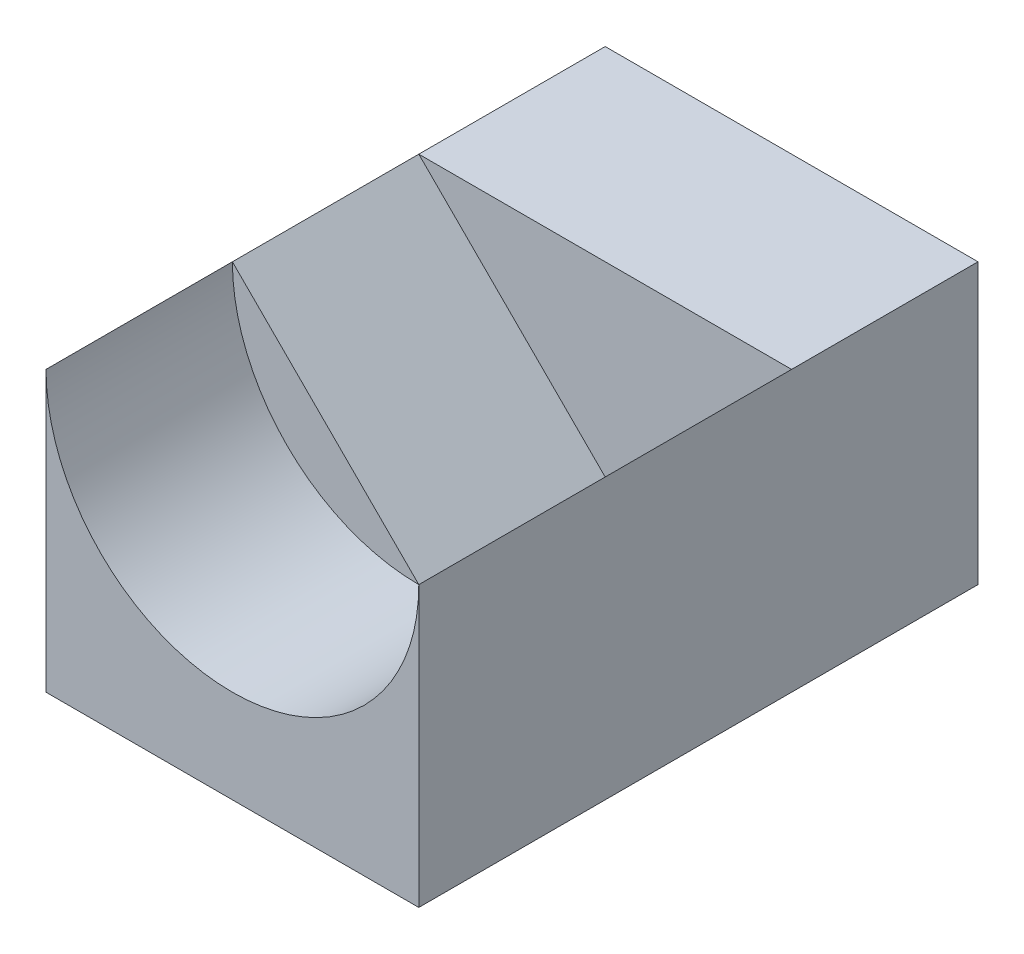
SolidWorks part; units mm, degrees
ref_plane "Front Plane" through (0, 0, 0) normal (0, 0, 1) x (1, 0, 0)
ref_plane "Top Plane" through (0, 0, 0) normal (0, 1, 0) x (1, 0, 0)
ref_plane "Right Plane" through (0, 0, 0) normal (1, 0, 0) x (0, 0, -1)
sketch "Sketch1" plane through (0, 0, 0) normal (0, 0, 1) x (1, 0, 0)
  line L1 (-20, 0) -> (20, 0)
  line L2 (-20, 0) -> (-20, 30)
  line L3 (-20, 30) -> (20, 30)
  line L4 (20, 0) -> (20, 30)
  dimension "D1" = 40
  dimension "D2" = 30
extrude "Extrude1" add sketch "Sketch1" along normal blind 60
sketch "Sketch2" plane through (0, 0, 60) normal (0, 0, 1) x (1, 0, 0)
  line L0 (20, 30) -> (-20, 30) construction
  circle A0 centre (0, 30) radius 20
extrude "Extrude2" cut sketch "Sketch2" against normal blind 20
sketch "Sketch3" plane through (0, 0, 40) normal (0, 0, 1) x (1, 0, 0)
  line L0 (-20, 30) -> (20, 30)
  line L1 (20, 30) -> (0, 10)
  line L2 (0, 10) -> (-20, 30)
  arc A0 (-20, 30) -> (20, 30) centre (0, 30) ccw construction
extrude "Extrude4" cut sketch "Sketch3" against normal blind 20
